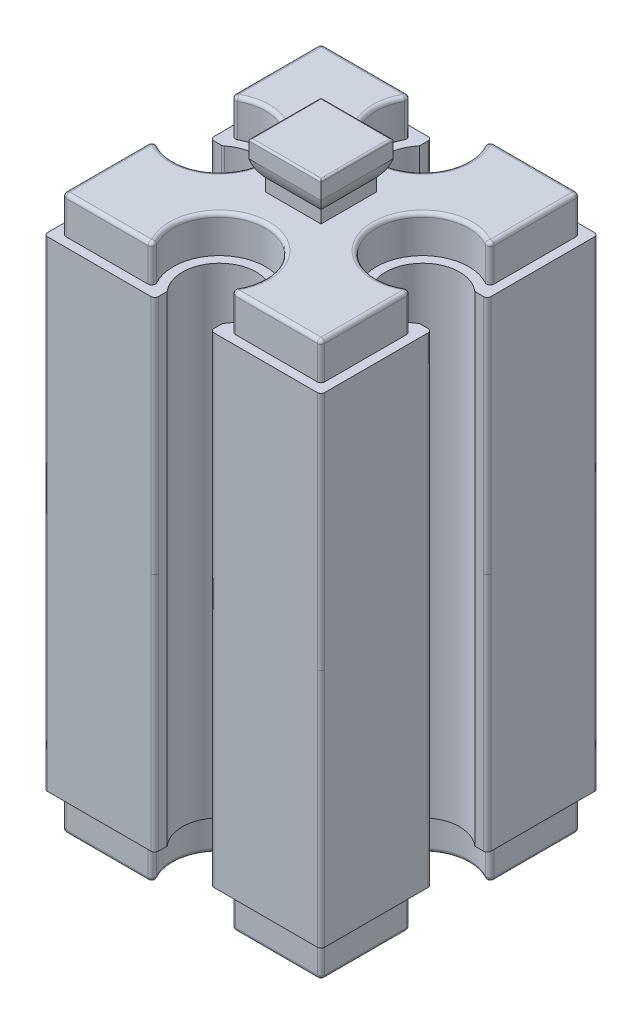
SolidWorks part; units mm, degrees
ref_plane "前视基准面" through (0, 0, 0) normal (0, 0, 1) x (1, 0, 0)
ref_plane "上视基准面" through (0, 0, 0) normal (0, 1, 0) x (1, 0, 0)
ref_plane "右视基准面" through (0, 0, 0) normal (1, 0, 0) x (0, 0, -1)
sketch "草图1" plane through (0, 0, 0) normal (0, 1, 0) x (1, 0, 0)
  line L0 (0, 0) -> (0, 7.5) construction
  line L1 (0, 0) -> (7.5, 0) construction
  line L2 (-7.5, 7.5) -> (-1.5, 7.5)
  line L3 (7.5, 7.5) -> (7.5, 1.5)
  line L4 (6.8229, 1.5) -> (7.5, 1.5)
  line L5 (6.8229, -1.5) -> (7.5, -1.5)
  line L6 (0, 7.5) -> (0, 5.5) construction
  line L7 (-1.5, 6.8229) -> (-1.5, 7.5)
  line L8 (1.5, 6.8229) -> (1.5, 7.5)
  line L9 (1.5, 7.5) -> (7.5, 7.5)
  line L10 (7.5, -1.5) -> (7.5, -7.5)
  line L11 (7.5, -7.5) -> (1.5, -7.5)
  line L12 (1.5, -6.8229) -> (1.5, -7.5)
  line L13 (-1.5, -6.8229) -> (-1.5, -7.5)
  line L14 (-1.5, -7.5) -> (-7.5, -7.5)
  line L15 (-7.5, -7.5) -> (-7.5, -1.5)
  line L16 (-6.8229, -1.5) -> (-7.5, -1.5)
  line L17 (-6.8229, 1.5) -> (-7.5, 1.5)
  line L18 (-7.5, 1.5) -> (-7.5, 7.5)
  arc A0 (-1.5, 6.8229) -> (1.5, 6.8229) centre (0, 5.5) ccw
  arc A1 (6.8229, 1.5) -> (6.8229, -1.5) centre (5.5, 0) ccw
  arc A2 (1.5, -6.8229) -> (-1.5, -6.8229) centre (0, -5.5) ccw
  arc A3 (-6.8229, -1.5) -> (-6.8229, 1.5) centre (-5.5, 0) ccw
  point P36 (0, 0)
  dimension "D6" = 4
  dimension "D7" = 2
  dimension "D1" = 7.5
  dimension "D2" = 7.5
  dimension "D3" = 2
  dimension "D4" = 7.5
  dimension "D5" = 1.5
extrude "凸台-拉伸1" add sketch "草图1" along normal blind 13
sketch "草图2" plane through (0, 13, 0) normal (0, 1, 0) x (1, 0, 0)
  line L0 (-7, 7) -> (-7, 2)
  line L1 (-7, 2) -> (-7, 2)
  line L2 (-7, -2) -> (-7, -2)
  line L3 (-7, -2) -> (-7, -7)
  line L4 (-7, -7) -> (-2, -7)
  line L5 (-2, -7) -> (-2, -7)
  line L6 (2, -7) -> (2, -7)
  line L7 (2, -7) -> (7, -7)
  line L8 (7, -7) -> (7, -2)
  line L9 (7, -2) -> (7, -2)
  line L10 (7, 2) -> (7, 2)
  line L11 (7, 2) -> (7, 7)
  line L12 (7, 7) -> (2, 7)
  line L13 (2, 7) -> (2, 7)
  line L14 (-2, 7) -> (-2, 7)
  line L15 (-2, 7) -> (-7, 7)
  line L16 (-7.5, 7.5) -> (-7.5, 1.5)
  line L17 (-7.5, 1.5) -> (-6.8229, 1.5)
  line L18 (-6.8229, -1.5) -> (-7.5, -1.5)
  line L19 (-7.5, -1.5) -> (-7.5, -7.5)
  line L20 (-7.5, -7.5) -> (-1.5, -7.5)
  line L21 (-1.5, -7.5) -> (-1.5, -6.8229)
  line L22 (1.5, -6.8229) -> (1.5, -7.5)
  line L23 (1.5, -7.5) -> (7.5, -7.5)
  line L24 (7.5, -7.5) -> (7.5, -1.5)
  line L25 (7.5, -1.5) -> (6.8229, -1.5)
  line L26 (6.8229, 1.5) -> (7.5, 1.5)
  line L27 (7.5, 1.5) -> (7.5, 7.5)
  line L28 (7.5, 7.5) -> (1.5, 7.5)
  line L29 (1.5, 7.5) -> (1.5, 6.8229)
  line L30 (-1.5, 6.8229) -> (-1.5, 7.5)
  line L31 (-1.5, 7.5) -> (-7.5, 7.5)
  line L32 (-7.5, 7.5) -> (-7.5, 1.5) construction
  line L33 (-7.5, 1.5) -> (-6.8229, 1.5) construction
  line L34 (-6.8229, -1.5) -> (-7.5, -1.5) construction
  line L35 (-7.5, -1.5) -> (-7.5, -7.5) construction
  line L36 (-7.5, -7.5) -> (-1.5, -7.5) construction
  line L37 (-1.5, -7.5) -> (-1.5, -6.8229) construction
  line L38 (1.5, -6.8229) -> (1.5, -7.5) construction
  line L39 (1.5, -7.5) -> (7.5, -7.5) construction
  line L40 (7.5, -7.5) -> (7.5, -1.5) construction
  line L41 (7.5, -1.5) -> (6.8229, -1.5) construction
  line L42 (6.8229, 1.5) -> (7.5, 1.5) construction
  line L43 (7.5, 1.5) -> (7.5, 7.5) construction
  line L44 (7.5, 7.5) -> (1.5, 7.5) construction
  line L45 (1.5, 7.5) -> (1.5, 6.8229) construction
  line L46 (-1.5, 6.8229) -> (-1.5, 7.5) construction
  line L47 (-1.5, 7.5) -> (-7.5, 7.5) construction
  arc A0 (-7, -2) -> (-7, 2) centre (-5.5, 0) ccw
  arc A1 (2, -7) -> (-2, -7) centre (0, -5.5) ccw
  arc A2 (7, 2) -> (7, -2) centre (5.5, 0) ccw
  arc A3 (-2, 7) -> (2, 7) centre (0, 5.5) ccw
  arc A4 (-6.8229, -1.5) -> (-6.8229, 1.5) centre (-5.5, 0) ccw
  arc A5 (1.5, -6.8229) -> (-1.5, -6.8229) centre (0, -5.5) ccw
  arc A6 (6.8229, 1.5) -> (6.8229, -1.5) centre (5.5, 0) ccw
  arc A7 (-1.5, 6.8229) -> (1.5, 6.8229) centre (0, 5.5) ccw
  arc A8 (-6.8229, -1.5) -> (-6.8229, 1.5) centre (-5.5, 0) ccw construction
  arc A9 (1.5, -6.8229) -> (-1.5, -6.8229) centre (0, -5.5) ccw construction
  arc A10 (6.8229, 1.5) -> (6.8229, -1.5) centre (5.5, 0) ccw construction
  arc A11 (-1.5, 6.8229) -> (1.5, 6.8229) centre (0, 5.5) ccw construction
  dimension "D1" = 0
  dimension "D2" = 0.5
extrude "凸台-拉伸2" add sketch "草图2" along normal blind 2
sketch "草图3" plane through (0, 0, 0) normal (1, 0, 0) x (0, 0, -1)
  line L0 (0, 15) -> (0, 17) construction
  line L1 (2.5, 15) -> (-2.5, 15) construction
  line L2 (0, 17) -> (0, 17.5) construction
  line L3 (-1.5, 15) -> (1.5, 15)
  line L4 (1.5, 15) -> (1.5, 15.6771)
  line L5 (-1.95, 17.5) -> (1.95, 17.5)
  line L6 (1.95, 17.5) -> (1.95, 16.5556)
  line L7 (-1.5, 15) -> (-1.5, 15.6771)
  line L8 (-1.95, 17.5) -> (-1.95, 16.5556)
  arc A0 (-1.5, 15.6771) -> (-1.95, 16.5556) centre (0, 17) cw
  arc A1 (1.5, 15.6771) -> (1.95, 16.5556) centre (0, 17) ccw
  dimension "D5" = 2
  dimension "D1" = 2
  dimension "D2" = 0.5
  dimension "D3" = 1.5
  dimension "D4" = 1.95
extrude "凸台-拉伸3" add sketch "草图3" along normal blind 2 and the other way blind 2
sketch "草图4" plane through (0, 0, 0) normal (0, 0, 1) x (1, 0, 0)
  line L0 (0, 15) -> (0, 17) construction
  line L2 (-2, 15) -> (2, 15) construction
  line L3 (0, 17) -> (0, 17.5) construction
  line L4 (-2, 17.5) -> (2, 17.5) construction
  line L5 (1.95, 17.5) -> (2, 17.5)
  line L6 (-1.95, 17.5) -> (-1.95, 16.5556)
  line L9 (-1.5, 15) -> (-1.5, 15.6771)
  line L10 (1.5, 15) -> (1.5, 15.6771)
  line L11 (1.95, 17.5) -> (1.95, 16.5556)
  line L12 (1.5, 15) -> (2, 15)
  line L13 (-2, 17.5) -> (-1.95, 17.5)
  line L14 (-2, 17.5) -> (-2, 15)
  line L15 (-2, 15) -> (-1.5, 15)
  line L16 (2, 17.5) -> (2, 15)
  arc A0 (-1.95, 16.5556) -> (-1.5, 15.6771) centre (0, 17) ccw
  arc A1 (1.95, 16.5556) -> (1.5, 15.6771) centre (0, 17) cw
  dimension "D1" = 2
  dimension "D2" = 1.5
  dimension "D3" = 1.95
fillet "圆角3" radius 0.2 13 edges at (-1.5, 6.5, -7.5) (1.5, 6.5, -7.5) (7.5, 6.5, -7.5) (7.5, 6.5, -1.5) (7.5, 6.5, 1.5) (7.5, 6.5, 7.5) (-1.5, 6.5, 7.5) (1.5, 6.5, 7.5) (-6.8229, 6.5, -1.5) (-7.5, 6.5, 7.5) (-7.5, 6.5, 1.5) (-7.5, 6.5, -1.5) (-7.5, 6.5, -7.5)
extrude "切除-拉伸1" cut sketch "草图4" against normal blind 3 and the other way blind 3
fillet "圆角4" radius 0.2 24 edges at (0, 15, 3) (-3, 15, 0) (0, 15, -3) (3, 15, 0) (7, 14, 2) (7, 14, -2) (2, 14, -7) (-2, 14, -7) (-7, 14, 2) (-7, 14, -2) (2, 14, 7) (-2, 14, 7) (7, 14, 7) (4.5, 15, 7) (7, 15, 4.5) (7, 15, -4.5) (7, 14, -7) (4.5, 15, -7) (-4.5, 15, -7) (-7, 14, -7) (-7, 15, -4.5) (-4.5, 15, 7) (-7, 15, 4.5) (-7, 14, 7)
fillet "圆角5" radius 0.1 4 edges at (0, 17.5, -1.95) (1.95, 17.5, 0) (0, 17.5, 1.95) (-1.95, 17.5, 0)
mirror "镜向1" of "圆角5", "圆角4", "切除-拉伸1", "圆角3", "凸台-拉伸3", "凸台-拉伸2", "凸台-拉伸1"
